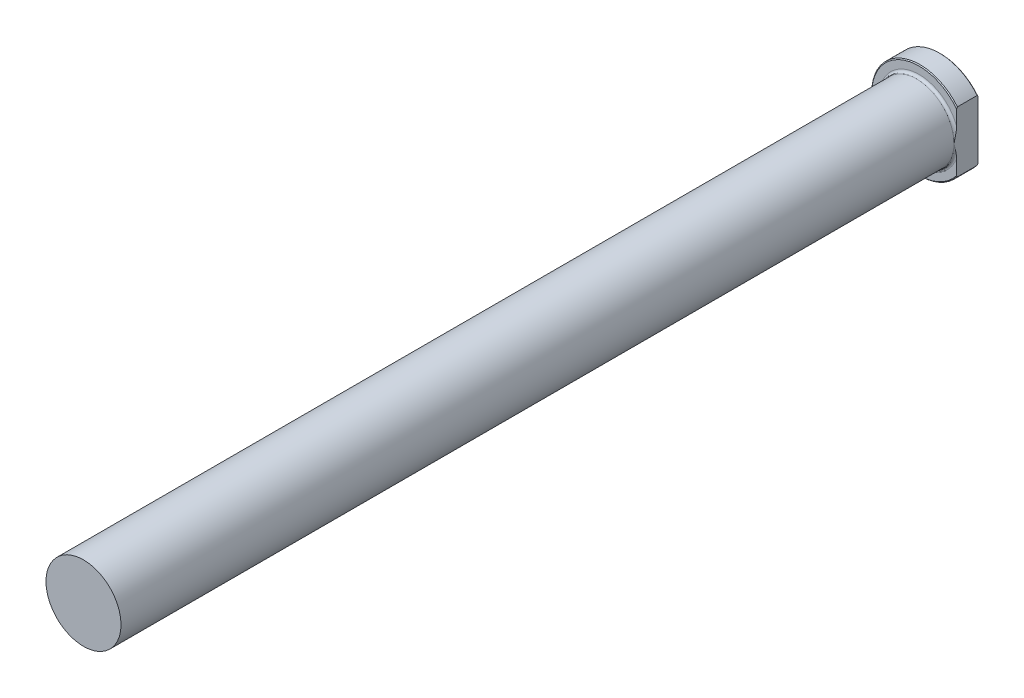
SolidWorks part; units mm, degrees
ref_plane "Front Plane" through (0, 0, 0) normal (0, 0, 1) x (1, 0, 0)
ref_plane "Top Plane" through (0, 0, 0) normal (0, 1, 0) x (1, 0, 0)
ref_plane "Right Plane" through (0, 0, 0) normal (1, 0, 0) x (0, 0, -1)
sketch "Sketch1" plane through (0, 0, 0) normal (1, 0, 0) x (0, 0, -1)
  line L0 (0, 0) -> (0, 14.2875)
  line L1 (0, 14.2875) -> (-6.35, 14.2875)
  line L2 (-6.35, 14.2875) -> (-6.35, 11.8745)
  line L3 (-7.112, 11.1125) -> (-254, 11.1125)
  line L4 (-254, 11.1125) -> (-254, 0)
  line L5 (-254, 0) -> (0, 0)
  line L6 (25.4347, 0) -> (-130.6739, 0) construction
  arc A0 (-6.35, 11.8745) -> (-7.112, 11.1125) centre (-7.112, 11.8745) cw
  dimension "D4" = 0.762
  dimension "D1" = 22.225
  dimension "D2" = 28.575
  dimension "D3" = 6.35
  dimension "D5" = 254
revolve "Revolve1" add sketch "Sketch1" angle 360 about L6
chamfer "Chamfer1" distance 0.254 angle 45 2 edges at (-14.2875, 0, 0) (-14.2875, 0, 6.35)
sketch "Sketch2" plane through (0, 0, 0) normal (0, 0, -1) x (-1, 0, 0)
  line L1 (-11.1125, 8.9803) -> (-11.1125, -8.9803)
  circle A1 centre (0, 0) radius 14.2875 construction
  circle A2 centre (0, 0) radius 11.1125 construction
  arc A5 (-11.1125, -8.9803) -> (-11.1125, 8.9803) centre (0, 0) cw
extrude "Cut-Extrude1" cut sketch "Sketch2" against normal up to next
